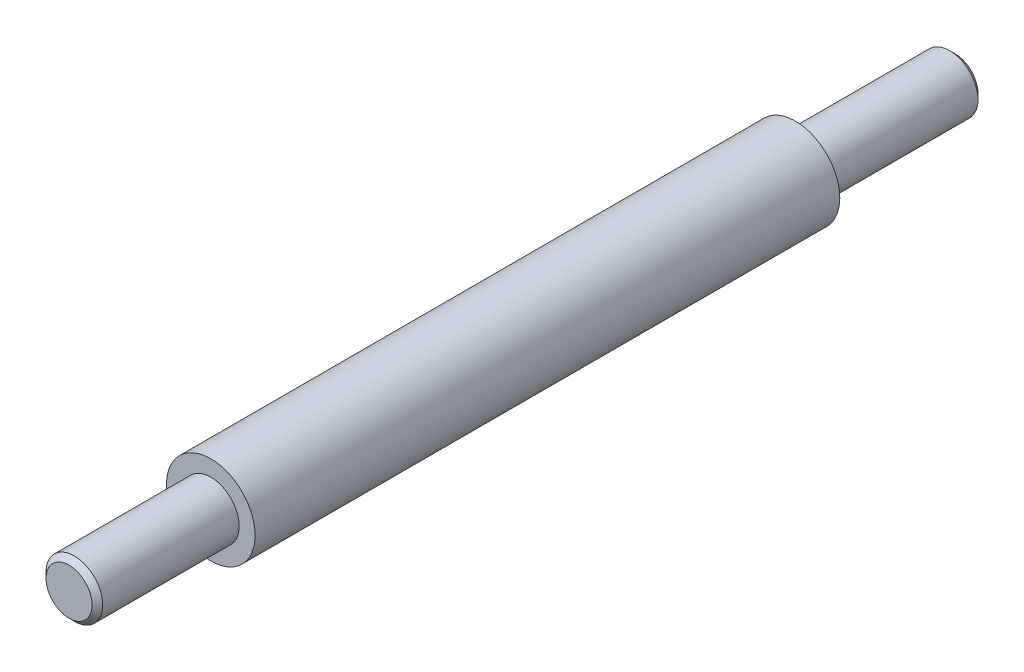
SolidWorks part; units mm, degrees
ref_plane "Plan de face" through (0, 0, 0) normal (0, 0, 1) x (1, 0, 0)
ref_plane "Plan de dessus" through (0, 0, 0) normal (0, 1, 0) x (1, 0, 0)
ref_plane "Plan de droite" through (0, 0, 0) normal (1, 0, 0) x (0, 0, -1)
sketch "Esquisse1" plane through (0, 0, 0) normal (0, 0, 1) x (1, 0, 0)
  circle A0 centre (0, 0) radius 12.5
  dimension "D1" = 25
extrude "Boss.-Extru.1" add sketch "Esquisse1" along normal blind 165
sketch "Esquisse2" plane through (0, 0, 0) normal (0, 0, -1) x (-1, 0, 0)
  circle A0 centre (0, 0) radius 8
  dimension "D1" = 16
extrude "Boss.-Extru.2" add sketch "Esquisse2" along normal blind 45
chamfer "Chanfrein1" distance 1.5 angle 45 1 edges at (-8, 0, -45)
sketch "Esquisse3" plane through (0, 0, 165) normal (0, 0, 1) x (1, 0, 0)
  circle A0 centre (0, 0) radius 8
  dimension "D1" = 16
extrude "Boss.-Extru.3" add sketch "Esquisse3" along normal blind 40
chamfer "Chanfrein2" distance 1.5 angle 45 1 edges at (8, 0, 205)
